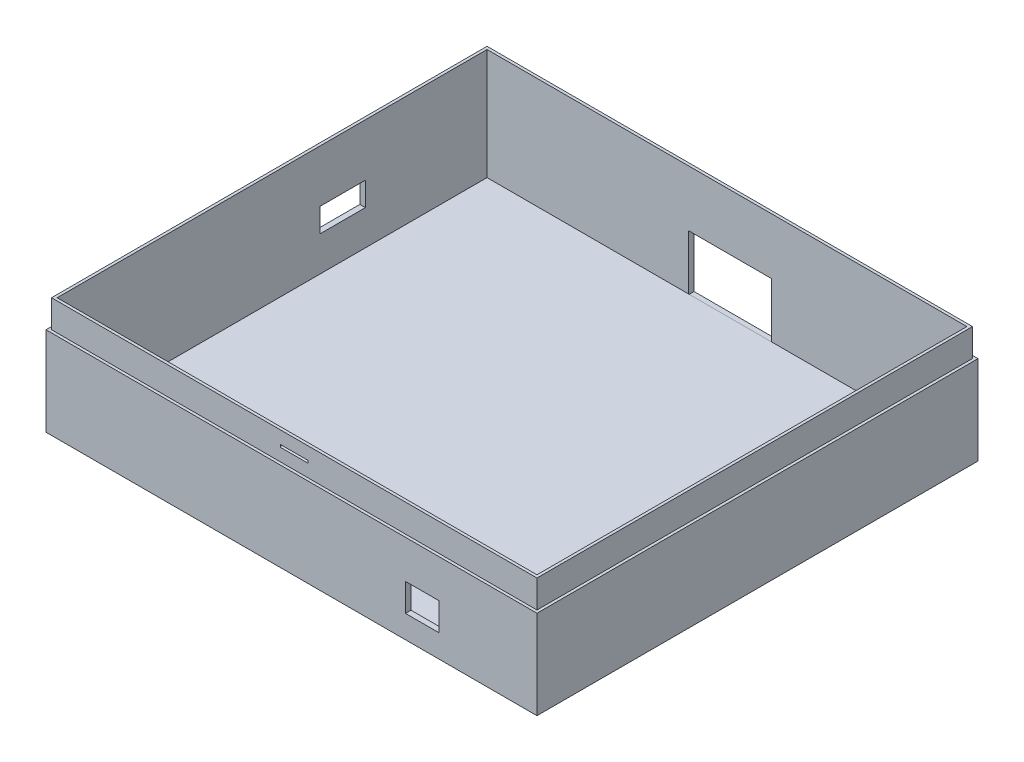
SolidWorks part; units mm, degrees
ref_plane "前视基准面" through (0, 0, 0) normal (0, 0, 1) x (1, 0, 0)
ref_plane "上视基准面" through (0, 0, 0) normal (0, 1, 0) x (1, 0, 0)
ref_plane "右视基准面" through (0, 0, 0) normal (1, 0, 0) x (0, 0, -1)
other "Configuration Table"
sketch "草图1" plane through (0, 0, 0) normal (0, 1, 0) x (1, 0, 0)
  line L1 (0, 0) -> (173, 0)
  line L2 (0, 0) -> (0, 155)
  line L3 (0, 155) -> (173, 155)
  line L4 (173, 0) -> (173, 155)
  dimension "D1" = 155
  dimension "D2" = 173
extrude "凸台-拉伸1" add sketch "草图1" along normal blind 2
sketch "草图2" plane through (0, 2, 0) normal (0, 1, 0) x (1, 0, 0)
  line L0 (173, 155) -> (0, 0)
  line L2 (-2, -2) -> (175, -2)
  line L3 (-2, -2) -> (-2, 157)
  line L4 (-2, 157) -> (175, 157)
  line L5 (175, -2) -> (175, 157)
  line L6 (-2, -2) -> (175, 157) construction
  line L7 (-2, 157) -> (175, -2) construction
  point P4 (86.5, 77.5)
  dimension "D1" = 159
  dimension "D2" = 177
extrude "凸台-拉伸2" add sketch "草图2" along normal blind 40 separate body contours L2 L5 L4 L3 M3 M6 M5 M4
sketch "草图3" plane through (0, 0, 0) normal (0, -1, 0) x (1, 0, 0)
  line L1 (-2, 2) -> (175, 2)
  line L2 (-2, 2) -> (-2, -157)
  line L3 (-2, -157) -> (175, -157)
  line L4 (175, 2) -> (175, -157)
extrude "凸台-拉伸3" add sketch "草图3" against normal blind 2
sketch "草图4" plane through (0, 0, -155) normal (0, 0, 1) x (1, 0, 0)
  line L1 (72.6352, 21.7554) -> (102.6352, 21.7554)
  line L2 (72.6352, 21.7554) -> (72.6352, 1.7554)
  line L3 (72.6352, 1.7554) -> (102.6352, 1.7554)
  line L4 (102.6352, 21.7554) -> (102.6352, 1.7554)
extrude "切除-拉伸1" cut sketch "草图4" against normal blind 21
sketch "草图5" plane through (0, 42, 0) normal (0, 1, 0) x (1, 0, 0)
  line L0 (175, -2) -> (-2, 157)
  line L2 (-1, 156) -> (174, 156)
  line L3 (-1, 156) -> (-1, -1)
  line L4 (-1, -1) -> (174, -1)
  line L5 (174, 156) -> (174, -1)
  line L6 (-1, 156) -> (174, -1) construction
  line L7 (-1, -1) -> (174, 156) construction
  point P4 (86.5, 77.5)
  dimension "D1" = 157
  dimension "D2" = 175
extrude "切除-拉伸2" cut sketch "草图5" against normal blind 10 contours L2 L5 L4 L0 M8 M9 | L4 L3 L2 L0 M10 M7
ref_plane "基准面1" through (86.5, 0, 0) normal (-1, 0, 0) x (0, 0, 1)
sketch "草图8" plane through (86.5, 0, 0) normal (-1, 0, 0) x (0, 0, 1)
  line L1 (-156, 37) -> (-156, 37.44)
  line L3 (-156, 37) -> (-156, 36.56)
  line L4 (-156, 37.44) -> (-155.56, 37)
  line L5 (-156, 36.56) -> (-155.56, 37)
  dimension "D1" = 0.44
  dimension "D2" = 0.44
  dimension "D3" = 0.44
extrude "切除-拉伸5" cut sketch "草图8" against normal blind 5 and the other way blind 5
ref_plane "基准面2" through (0, 0, -77.5) normal (0, 0, 1) x (1, 0, 0)
mirror "镜向1" about plane through (0, 0, -77.5) normal (0, 0, 1) of "切除-拉伸5"
sketch "草图11" plane through (-2, 0, 0) normal (-1, 0, 0) x (0, 0, 1)
  line L0 (-153.0037, 2) -> (-103.0037, 2)
  line L1 (-155, 2) -> (0, 2) construction
  line L2 (-103.0037, 2) -> (-103.0037, 19)
  line L4 (-111.3037, 14.574) -> (-94.7037, 14.574)
  line L5 (-111.3037, 14.574) -> (-111.3037, 23.426)
  line L6 (-111.3037, 23.426) -> (-94.7037, 23.426)
  line L7 (-94.7037, 14.574) -> (-94.7037, 23.426)
  line L8 (-111.3037, 14.574) -> (-94.7037, 23.426) construction
  line L9 (-111.3037, 23.426) -> (-94.7037, 14.574) construction
  dimension "D1" = 50
  dimension "D2" = 17
  dimension "D4" = 16.6
extrude "切除-拉伸6" cut sketch "草图11" against normal blind 5
ref_plane "基准面3" through (165.5125, 2, -1.7468) normal (0, -1, 0) x (-1, 0, 0)
sketch "草图13" plane through (0, 0, 2) normal (0, 0, 1) x (1, 0, 0)
  line L0 (97.5125, 2) -> (165.5125, 2)
  line L3 (127.606, 8.2402) -> (139.606, 8.2402)
  line L4 (127.606, 8.2402) -> (127.606, 18.2402)
  line L5 (127.606, 18.2402) -> (139.606, 18.2402)
  line L6 (139.606, 8.2402) -> (139.606, 18.2402)
  line L7 (127.606, 8.2402) -> (139.606, 18.2402) construction
  line L8 (127.606, 18.2402) -> (139.606, 8.2402) construction
  dimension "D1" = 12
  dimension "D2" = 10
extrude "切除-拉伸7" cut sketch "草图13" against normal blind 5 contours L3 L6 L5 L4
sketch "草图14" plane through (-2, 0, 0) normal (-1, 0, 0) x (0, 0, 1)
  line L1 (-111.3037, 23.426) -> (-94.7037, 23.426)
  line L2 (-111.3037, 23.426) -> (-111.3037, 14.574)
  line L3 (-111.3037, 14.574) -> (-94.7037, 14.574)
  line L4 (-94.7037, 23.426) -> (-94.7037, 14.574)
extrude "凸台-拉伸4" add sketch "草图14" against normal blind 2
sketch "草图15" plane through (-2, 0, 0) normal (-1, 0, 0) x (0, 0, 1)
  line L0 (-153.0037, 2) -> (-103.0037, 2)
  line L1 (-155, 2) -> (0, 2) construction
  line L4 (-111.1537, 14.5593) -> (-94.8537, 14.5593)
  line L5 (-111.1537, 14.5593) -> (-111.1537, 23.1276)
  line L6 (-111.1537, 23.1276) -> (-94.8537, 23.1276)
  line L7 (-94.8537, 14.5593) -> (-94.8537, 23.1276)
  line L8 (-111.1537, 14.5593) -> (-94.8537, 23.1276) construction
  line L9 (-111.1537, 23.1276) -> (-94.8537, 14.5593) construction
  dimension "D2" = 16.3
extrude "切除-拉伸8" cut sketch "草图15" against normal blind 2 contours L4 L7 L6 L5
